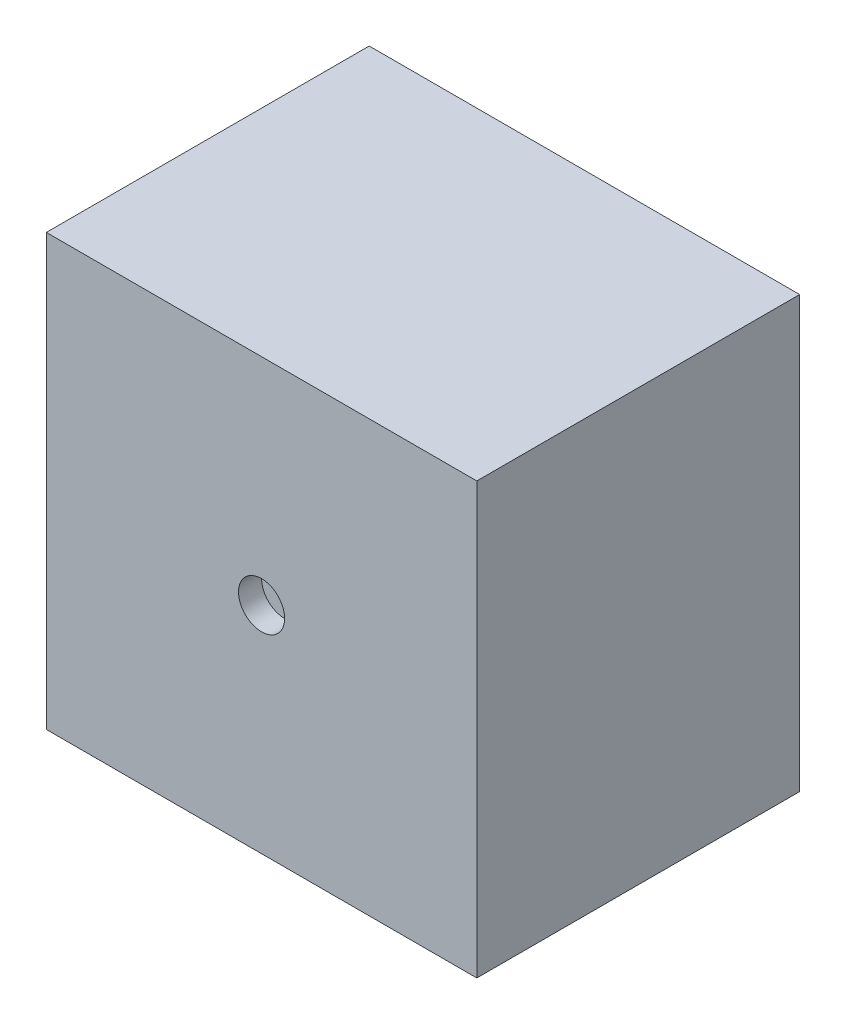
SolidWorks part; units mm, degrees
ref_plane "Front Plane" through (0, 0, 0) normal (0, 0, 1) x (1, 0, 0)
ref_plane "Top Plane" through (0, 0, 0) normal (0, 1, 0) x (1, 0, 0)
ref_plane "Right Plane" through (0, 0, 0) normal (1, 0, 0) x (0, 0, -1)
sketch "Sketch3" plane through (0, 0, 0) normal (0, 0, 1) x (1, 0, 0)
  line L1 (0, 0) -> (-56, 0)
  line L2 (0, 0) -> (0, 56)
  line L3 (0, 56) -> (-56, 56)
  line L4 (-56, 0) -> (-56, 56)
  line L5 (0, 0) -> (-56, 56) construction
  line L6 (0, 56) -> (-56, 0) construction
  point P5 (-28, 28)
  dimension "D1" = 56
  dimension "D2" = 56
extrude "Boss-Extrude1" add sketch "Sketch3" along normal blind 42
sketch "Sketch4" plane through (0, 0, 42) normal (0, 0, 1) x (1, 0, 0)
  line L0 (0, -30.8) -> (0, 30.8) construction
  line L1 (30.8, 0) -> (-30.8, 0) construction
  circle A0 centre (-28, 28) radius 3
  dimension "D1" = 6
  dimension "D2" = 28
  dimension "D3" = 28
extrude "Cut-Extrude1" cut sketch "Sketch4" against normal blind 3
